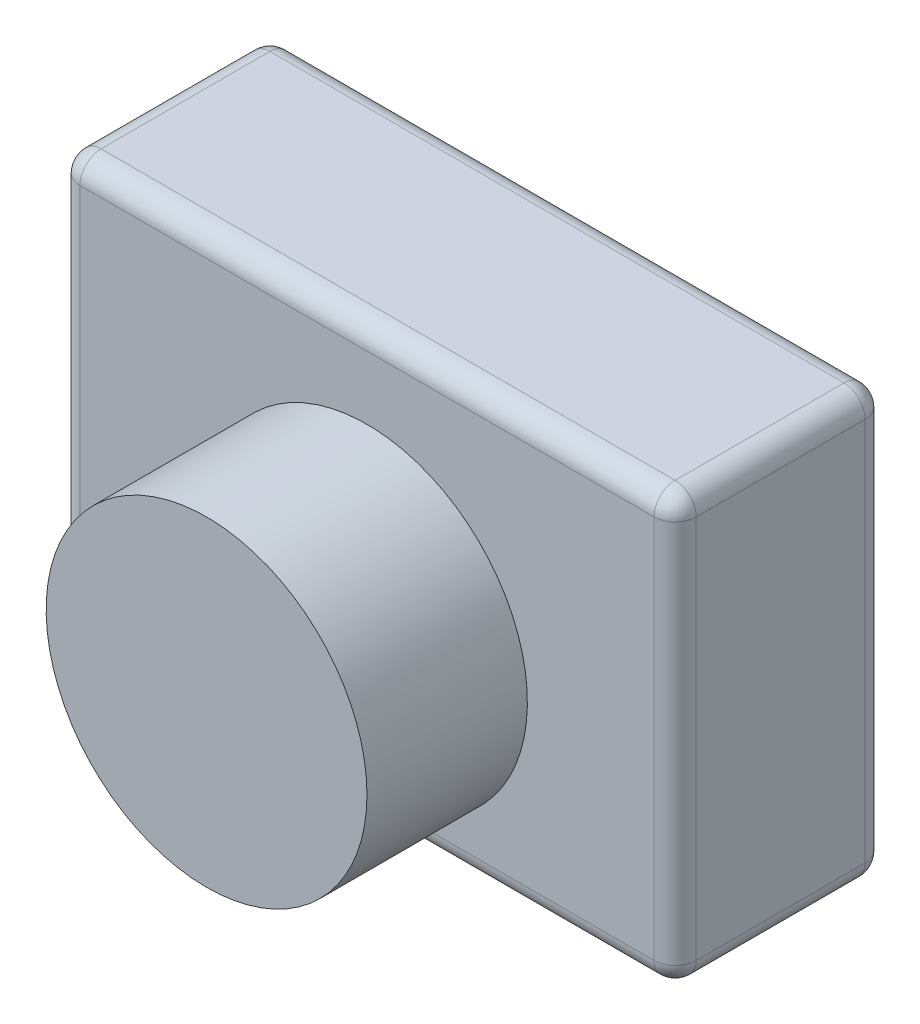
SolidWorks part; units mm, degrees
ref_plane "Front Plane" through (0, 0, 0) normal (0, 0, 1) x (1, 0, 0)
ref_plane "Top Plane" through (0, 0, 0) normal (0, 1, 0) x (1, 0, 0)
ref_plane "Right Plane" through (0, 0, 0) normal (1, 0, 0) x (0, 0, -1)
sketch "Sketch1" plane through (0, 0, 0) normal (0, 0, 1) x (1, 0, 0)
  line L1 (-20.3951, 18.2379) -> (125.6049, 18.2379)
  line L2 (-20.3951, 18.2379) -> (-20.3951, -82.7621)
  line L3 (-20.3951, -82.7621) -> (125.6049, -82.7621)
  line L4 (125.6049, 18.2379) -> (125.6049, -82.7621)
  dimension "D1" = 146
  dimension "D2" = 101
extrude "Boss-Extrude1" add sketch "Sketch1" along normal blind 50
fillet "Fillet1" radius 5 12 edges at (125.6049, -32.2621, 50) (-20.3951, -32.2621, 50) (125.6049, 18.2379, 25) (52.6049, 18.2379, 50) (-20.3951, 18.2379, 25) (125.6049, -32.2621, 0) (52.6049, 18.2379, 0) (-20.3951, -32.2621, 0) (-20.3951, -82.7621, 25) (52.6049, -82.7621, 50) (125.6049, -82.7621, 25) (52.6049, -82.7621, 0)
sketch "Sketch2" plane through (0, 0, 50) normal (0, 0, 1) x (1, 0, 0)
  line L0 (-15.3951, -77.7621) -> (120.6049, -77.7621) construction
  line L1 (120.6049, -77.7621) -> (120.6049, 13.2379) construction
  circle A0 centre (52.6049, -39.7621) radius 38
  dimension "D1" = 38
  dimension "D2" = 68
extrude "Boss-Extrude2" add sketch "Sketch2" along normal blind 38
hole_wizard "#6 Clearance Hole1" positions "Sketch4" profile "Sketch3" hole size "#6" standard "Ansi Inch"
sketch "Sketch4" plane through (0, -82.7621, 0) normal (0, -1, 0) x (1, 0, 0)
  point P0 (24, 25)
  point P1 (74, 25)
sketch "Sketch3" plane through (24, -82.7621, 25) normal (1, 0, 0) x (0, 0, -1)
  line L0 (0, 0) -> (0, 6.1408)
  line L1 (0, 6.1408) -> (1.8986, 5)
  line L2 (1.8986, 5) -> (1.8986, 0)
  line L5 (1.8986, 0) -> (0, 0)
  line L10 (0, 6.1408) -> (-1.8986, 5) construction
  line L11 (0, -6.35) -> (0, 107.95) construction
  dimension "Hole Dia." = 3.7973
  dimension "Hole Depth" = 5
  dimension "Drill Angle" = 118
